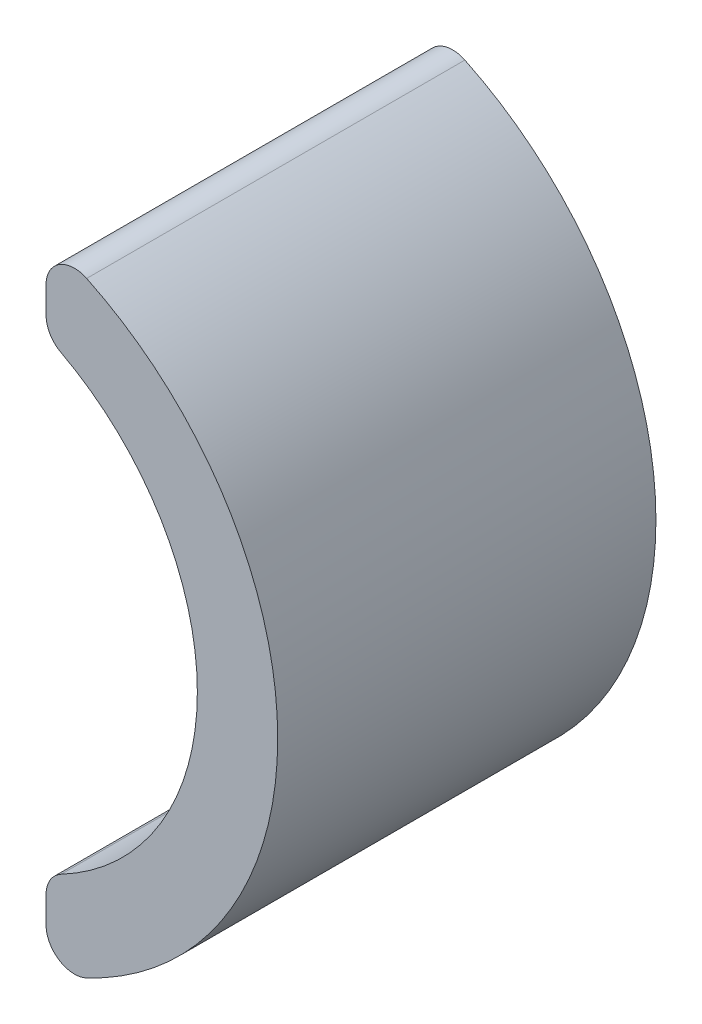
SolidWorks part; units mm, degrees
ref_plane "Plan de face" through (0, 0, 0) normal (0, 0, 1) x (1, 0, 0)
ref_plane "Plan de dessus" through (0, 0, 0) normal (0, 1, 0) x (1, 0, 0)
ref_plane "Plan de droite" through (0, 0, 0) normal (1, 0, 0) x (0, 0, -1)
sketch "Esquisse1" plane through (0, 0, 0) normal (0, 0, 1) x (1, 0, 0)
  circle A0 centre (0, -36.1) radius 40
  dimension "D1" = 80
extrude "Extrusion1" add sketch "Esquisse1" along normal blind 93.5
ref_plane "Plan1" through (0, 0, -5.8) normal (0, 0, -1) x (-1, 0, 0)
sketch "Esquisse5" plane through (0, 0, -5.8) normal (0, 0, -1) x (-1, 0, 0)
  circle A1 centre (0, -36.1) radius 35.5
  dimension "D1" = 71
extrude "Enlèv. mat.-Extru.1" cut sketch "Esquisse5" against normal through all
ref_plane "Plan2" through (0, 0, 18.5) normal (0, 0, -1) x (-1, 0, 0)
sketch "Esquisse6" plane through (0, 0, 18.5) normal (0, 0, -1) x (-1, 0, 0)
  line L0 (11, -62.633) -> (11, -65.43)
  line L1 (-11, -62.633) -> (-11, -65.43)
  line L2 (-11, -6.77) -> (-11, -9.567)
  line L4 (11, -6.77) -> (11, -9.567)
  arc A0 (-12.6, -12.2203) -> (-12.6, -59.9797) centre (0, -36.1) ccw
  circle A1 centre (0, -36.1) radius 35.5 construction
  arc A2 (-15.2923, -4.0626) -> (-15.2923, -68.1374) centre (0, -36.1) ccw
  arc A3 (15.2923, -68.1374) -> (15.2923, -4.0626) centre (0, -36.1) ccw
  arc A4 (12.6, -59.9797) -> (12.6, -12.2203) centre (0, -36.1) ccw
  arc A5 (-11, -6.77) -> (-15.2923, -4.0626) centre (-14, -6.77) ccw
  arc A6 (-12.6, -12.2203) -> (-11, -9.567) centre (-14, -9.567) ccw
  arc A7 (12.6, -12.2203) -> (11, -9.567) centre (14, -9.567) cw
  arc A8 (15.2923, -4.0626) -> (11, -6.77) centre (14, -6.77) ccw
  arc A9 (11, -62.633) -> (12.6, -59.9797) centre (14, -62.633) cw
  arc A10 (11, -65.43) -> (15.2923, -68.1374) centre (14, -65.43) ccw
  arc A11 (-15.2923, -68.1374) -> (-11, -65.43) centre (-14, -65.43) ccw
  arc A12 (-12.6, -59.9797) -> (-11, -62.633) centre (-14, -62.633) cw
  point P20 (11, -60.7577)
  point P23 (11, -69.8528)
  point P28 (-11, -60.7577)
  dimension "D1" = 54
  dimension "D4" = 3
  dimension "D5" = 3
  dimension "D2" = 22
  dimension "D3" = 11
extrude "Extrusion2" add sketch "Esquisse6" against normal blind 40
sketch "Esquisse7" plane through (0, 0, 0) normal (0, 0, -1) x (-1, 0, 0)
  line L2 (11, -62.633) -> (11, -65.43)
  line L3 (11, -6.77) -> (11, -9.567)
  line L4 (11, -62.633) -> (11, -65.43)
  line L5 (11, -6.77) -> (11, -9.567)
  circle A0 centre (0, -36.1) radius 35.5 construction
  circle A1 centre (0, -36.1) radius 40
  circle A2 centre (0, -36.1) radius 40
  arc A3 (15.2923, -4.0626) -> (15.2923, -68.1374) centre (0, -36.1) ccw
  arc A10 (11, -9.567) -> (12.6, -12.2203) centre (14, -9.567) ccw
  arc A11 (12.6, -59.9797) -> (12.6, -12.2203) centre (0, -36.1) ccw
  arc A12 (12.6, -59.9797) -> (11, -62.633) centre (14, -62.633) ccw
  arc A13 (11, -65.43) -> (15.2923, -68.1374) centre (14, -65.43) ccw
  arc A14 (15.2923, -68.1374) -> (15.2923, -4.0626) centre (0, -36.1) ccw
  arc A15 (15.2923, -4.0626) -> (11, -6.77) centre (14, -6.77) ccw
  arc A16 (11, -9.567) -> (12.6, -12.2203) centre (14, -9.567) ccw
  arc A17 (12.6, -59.9797) -> (12.6, -12.2203) centre (0, -36.1) ccw
  arc A18 (12.6, -59.9797) -> (11, -62.633) centre (14, -62.633) ccw
  arc A19 (11, -65.43) -> (15.2923, -68.1374) centre (14, -65.43) ccw
  arc A21 (15.2923, -4.0626) -> (11, -6.77) centre (14, -6.77) ccw
  dimension "D1" = 0
  dimension "D2" = 0
extrude "Enlèv. mat.-Extru.2" cut sketch "Esquisse7" against normal through all
